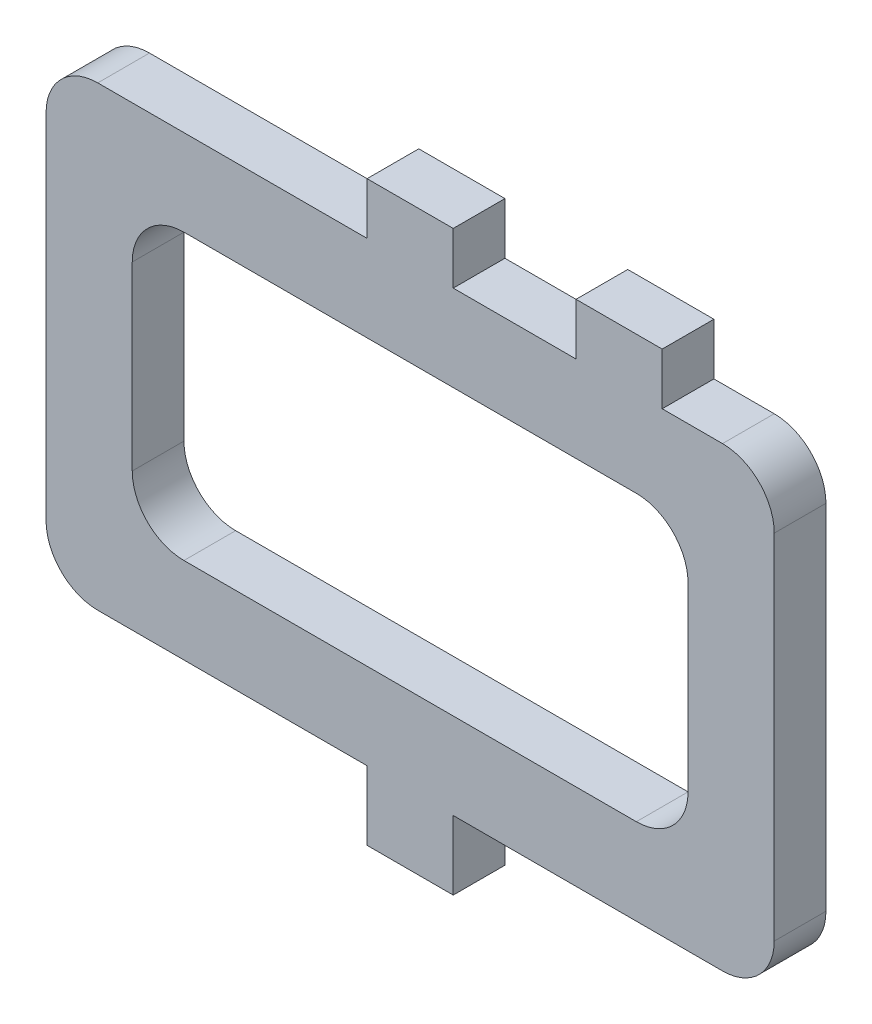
SolidWorks part; units mm, degrees
ref_plane "Alzado" through (0, 0, 0) normal (0, 0, 1) x (1, 0, 0)
ref_plane "Planta" through (0, 0, 0) normal (0, 1, 0) x (1, 0, 0)
ref_plane "Vista lateral" through (0, 0, 0) normal (1, 0, 0) x (0, 0, -1)
sketch "Croquis1" plane through (0, 0, 0) normal (0, 0, 1) x (1, 0, 0)
  line L0 (-102.6151, -90.722) -> (-86.9901, -90.722)
  line L1 (-90.4901, -61.222) -> (-90.4901, -64.222)
  line L2 (-107.6151, -61.222) -> (-105.1151, -61.222)
  line L3 (-90.4901, -64.222) -> (-86.9901, -64.222)
  line L4 (-107.6151, -90.722) -> (-123.2401, -90.722)
  line L5 (-105.1151, -61.222) -> (-102.6151, -61.222)
  line L6 (-102.6151, -61.222) -> (-102.6151, -64.222)
  line L7 (-95.4901, -61.222) -> (-95.4901, -64.222)
  line L8 (-95.4901, -64.222) -> (-102.6151, -64.222)
  line L9 (-123.2401, -64.222) -> (-107.6151, -64.222)
  line L15 (-83.9901, -87.722) -> (-83.9901, -67.222)
  line L24 (-107.6151, -61.222) -> (-107.6151, -64.222)
  line L26 (-107.6151, -94.722) -> (-107.6151, -90.722)
  line L27 (-102.6151, -94.722) -> (-102.6151, -90.722)
  line L28 (-105.1151, -94.722) -> (-102.6151, -94.722)
  line L29 (-107.6151, -94.722) -> (-105.1151, -94.722)
  line L31 (-95.4901, -61.222) -> (-90.4901, -61.222)
  line L32 (-126.2401, -87.722) -> (-126.2401, -67.222)
  arc A0 (-126.2401, -87.722) -> (-123.2401, -90.722) centre (-123.2401, -87.722) ccw
  arc A1 (-86.9901, -90.722) -> (-83.9901, -87.722) centre (-86.9901, -87.722) ccw
  arc A2 (-83.9901, -67.222) -> (-86.9901, -64.222) centre (-86.9901, -67.222) ccw
  arc A3 (-126.2401, -67.222) -> (-123.2401, -64.222) centre (-123.2401, -67.222) cw
  dimension "D1" = 3
extrude "Saliente-Extruir1" add sketch "Croquis1" along normal blind 3
sketch "Croquis2" plane through (0, 0, 3) normal (0, 0, 1) x (1, 0, 0)
  line L8 (-115.4276, -69.222) -> (-91.9901, -69.222)
  line L9 (-88.9901, -72.222) -> (-88.9901, -82.722)
  line L10 (-91.9901, -85.722) -> (-118.2401, -85.722)
  line L11 (-121.2401, -82.722) -> (-121.2401, -72.222)
  line L12 (-118.2401, -69.222) -> (-115.4276, -69.222)
  arc A0 (-118.2401, -85.722) -> (-121.2401, -82.722) centre (-118.2401, -82.722) cw
  arc A1 (-88.9901, -82.722) -> (-91.9901, -85.722) centre (-91.9901, -82.722) cw
  arc A2 (-91.9901, -69.222) -> (-88.9901, -72.222) centre (-91.9901, -72.222) cw
  arc A3 (-121.2401, -72.222) -> (-118.2401, -69.222) centre (-118.2401, -72.222) cw
  dimension "D1" = 3
extrude "Cortar-Extruir1" cut sketch "Croquis2" against normal blind 4
